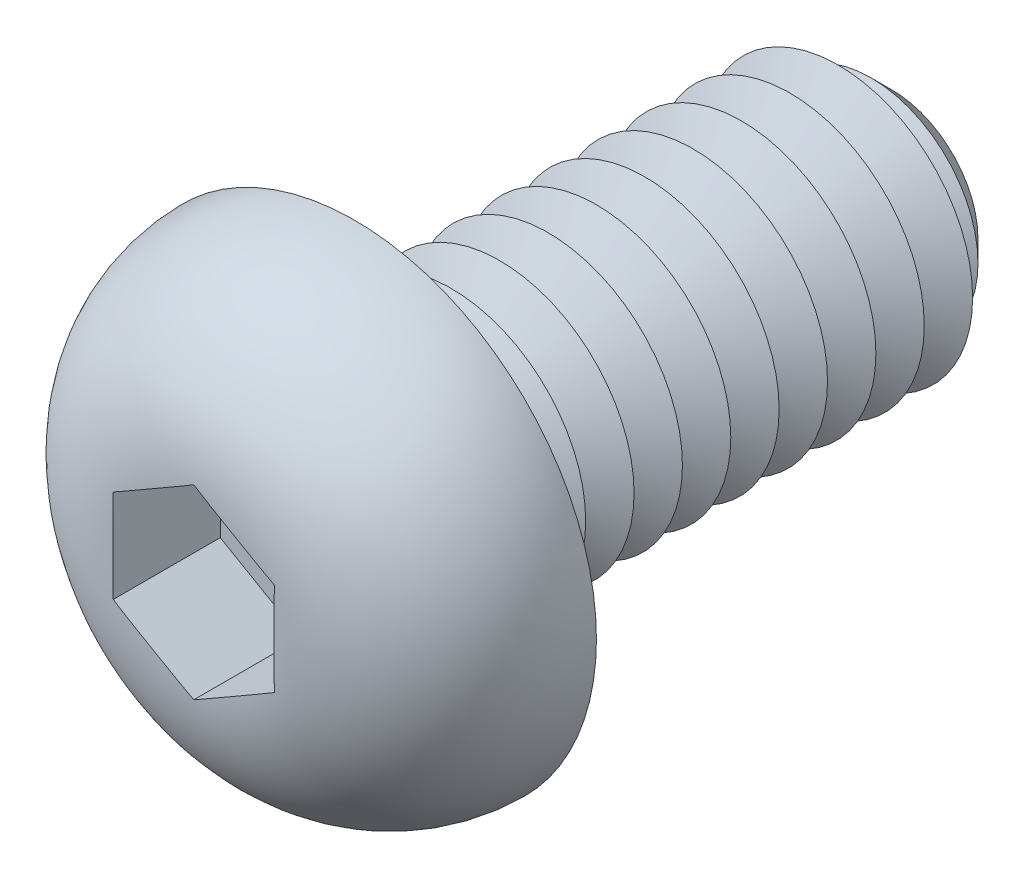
SolidWorks part; units mm, degrees
ref_plane "Front Plane" through (0, 0, 0) normal (0, 0, 1) x (1, 0, 0)
ref_plane "Top Plane" through (0, 0, 0) normal (0, 1, 0) x (1, 0, 0)
ref_plane "Right Plane" through (0, 0, 0) normal (1, 0, 0) x (0, 0, -1)
sketch "Sketch1" plane through (0, 0, 0) normal (1, 0, 0) x (0, 0, -1)
  line L0 (-47.9342, 0) -> (60.3146, 0) construction
sketch "Sketch2" plane through (0, 0, 0) normal (1, 0, 0) x (0, 0, -1)
  line L0 (0, 0) -> (-1.5, 0)
  line L1 (-47.9342, 0) -> (60.3146, 0) construction
  line L2 (-1.5, 0) -> (-1.5, 0.75)
  line L3 (0, 2.25) -> (0, 0)
  arc A0 (-1.5, 0.75) -> (0, 2.25) centre (0, 0.75) cw
  dimension "D1" = 1.5
  dimension "D2" = 1.5
  dimension "D3" = 2.25
revolve "Revolve1" add sketch "Sketch2" angle 360 about L0
sketch "Sketch3" plane through (0, 0, 1.5) normal (0, 0, 1) x (1, 0, 0)
  line L1 (0, 0.866) -> (-0.75, 0.433)
  line L2 (-0.75, 0.433) -> (-0.75, -0.433)
  line L3 (-0.75, -0.433) -> (0, -0.866)
  line L4 (0, -0.866) -> (0.75, -0.433)
  line L5 (0.75, -0.433) -> (0.75, 0.433)
  line L6 (0.75, 0.433) -> (0, 0.866)
  circle A0 centre (0, 0) radius 0.75 construction
  dimension "D1" = 1.5
extrude "Cut-Extrude1" cut sketch "Sketch3" against normal blind 1
sketch "Sketch4" plane through (0, 0, 0) normal (0, 0, -1) x (-1, 0, 0)
  circle A0 centre (0, 0) radius 1.25
  dimension "D1" = 2.5
extrude "Boss-Extrude1" add sketch "Sketch4" along normal blind 5
chamfer "Chamfer1" distance 0.45 angle 45 1 edges at (-1.25, 0, -5)
sketch "Sketch5" plane through (0, 0, 0) normal (1, 0, 0) x (0, 0, -1)
  line L0 (0.45, 1.25) -> (0.9, 1.25)
  line L1 (4.55, 1.25) -> (0, 1.25) construction
  line L2 (0.9, 1.25) -> (0.675, 0.8603)
  line L3 (0.675, 0.8603) -> (0.45, 1.25)
  line L4 (0, -2.25) -> (0, 2.25) construction
  line L5 (4.55, 1.25) -> (0, 1.25) construction
  dimension "D1" = 0.45
  dimension "D2" = 0.45
revolve "Cut-Revolve1" cut sketch "Sketch5" angle 360 about L0
pattern_linear "LPattern1" count 10 spacing 0.45 along (0, 0, -1) of "Cut-Revolve1"
fillet "Fillet2" radius 0.225 1 edges at (1.25, 0, 0)
sketch "Sketch6" plane through (0, 0, 0.5) normal (0, 0, 1) x (1, 0, 0)
  circle A0 centre (0, 0) radius 0.45
  dimension "D1" = 0.9
extrude "Cut-Extrude2" cut sketch "Sketch6" against normal up to surface (5.5 mm away)
